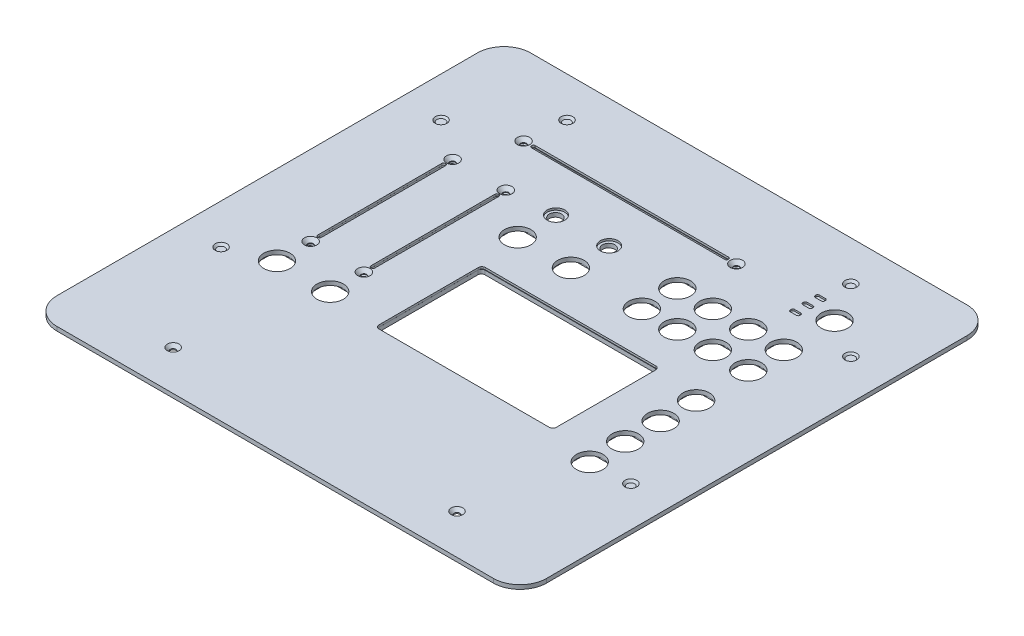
SolidWorks part; units mm, degrees
other "<P-2312 FRONTAL CONSOLA MARINE VIEW>-<Redondeo5>"
other "<P-2312 V02 FRONTAL CONSOLA MARINE VIEW>-<Redondeo5>"
ref_plane "Alzado" through (0, 0, 0) normal (0, 0, 1) x (1, 0, 0)
ref_plane "Planta" through (0, 0, 0) normal (0, 1, 0) x (1, 0, 0)
ref_plane "Vista lateral" through (0, 0, 0) normal (1, 0, 0) x (0, 0, -1)
inserted part "P-2312 V02 FRONTAL CONSOLA MARINE VIEW"
sketch "Croquis2" plane through (0, 2.3, 0) normal (0, 1, 0) x (1, 0, 0)
  line L8 (-39.8558, 56.2352) -> (-31.3705, 64.7204) construction
  line L9 (-106.3558, -34.4648) -> (-85.7558, -34.4648)
  line L10 (-106.3558, -34.4648) -> (-106.3558, -55.0648)
  line L11 (-106.3558, -55.0648) -> (-85.7558, -55.0648)
  line L12 (-85.7558, -34.4648) -> (-85.7558, -55.0648)
  line L13 (-76.3558, -34.4648) -> (-55.7558, -34.4648)
  line L14 (-76.3558, -34.4648) -> (-76.3558, -55.0648)
  line L15 (-76.3558, -55.0648) -> (-55.7558, -55.0648)
  line L16 (-55.7558, -34.4648) -> (-55.7558, -55.0648)
  line L17 (-50.0558, 44.7852) -> (-29.6558, 44.7852)
  line L18 (-50.0558, 44.7852) -> (-50.0558, 24.3852)
  line L19 (-50.0558, 24.3852) -> (-29.6558, 24.3852)
  line L20 (-29.6558, 44.7852) -> (-29.6558, 24.3852)
  line L21 (-20.0558, 44.7852) -> (0.3442, 44.7852)
  line L22 (-20.0558, 44.7852) -> (-20.0558, 24.3852)
  line L23 (-20.0558, 24.3852) -> (0.3442, 24.3852)
  line L24 (0.3442, 44.7852) -> (0.3442, 24.3852)
  line L25 (-88.7558, -36.4648) -> (-103.3558, -36.4648) construction
  line L26 (79.9442, 15.3852) -> (100.5442, 15.3852)
  line L27 (79.9442, 15.3852) -> (79.9442, -65.2148)
  line L28 (79.9442, -65.2148) -> (100.5442, -65.2148)
  line L29 (100.5442, 15.3852) -> (100.5442, -65.2148)
  line L30 (19.9442, 64.8852) -> (100.5442, 64.8852)
  line L31 (19.9442, 64.8852) -> (19.9442, 24.2852)
  line L32 (19.9442, 24.2852) -> (100.5442, 24.2852)
  line L33 (100.5442, 64.8852) -> (100.5442, 24.2852)
  line L34 (79.9442, 93.5352) -> (100.5442, 93.5352)
  line L35 (79.9442, 93.5352) -> (79.9442, 72.9352)
  line L36 (79.9442, 72.9352) -> (100.5442, 72.9352)
  line L37 (100.5442, 93.5352) -> (100.5442, 72.9352)
  line L38 (-103.3558, -53.0648) -> (-88.7558, -53.0648) construction
  line L39 (-104.3558, -37.4648) -> (-104.3558, -52.0648) construction
  line L40 (-87.7558, -52.0648) -> (-87.7558, -37.4648) construction
  line L41 (-74.3558, -37.4648) -> (-74.3558, -52.0648) construction
  line L42 (-57.7558, -52.0648) -> (-57.7558, -37.4648) construction
  line L43 (-58.7558, -36.4648) -> (-73.3558, -36.4648) construction
  line L44 (-73.3558, -53.0648) -> (-58.7558, -53.0648) construction
  line L45 (82.9442, -63.2148) -> (97.5442, -63.2148) construction
  line L46 (98.5442, -62.2148) -> (98.5442, -47.6148) construction
  line L47 (81.9442, -47.6148) -> (81.9442, -62.2148) construction
  line L48 (97.5442, 13.3852) -> (82.9442, 13.3852) construction
  line L49 (62.9442, 26.2852) -> (77.5442, 26.2852) construction
  line L50 (98.5442, 27.2852) -> (98.5442, 41.8852) construction
  line L51 (57.5442, 62.8852) -> (42.9442, 62.8852) construction
  line L52 (21.9442, 61.8852) -> (21.9442, 47.2852) construction
  line L53 (82.9442, 74.9352) -> (97.5442, 74.9352) construction
  line L54 (97.5442, 91.5352) -> (82.9442, 91.5352) construction
  line L55 (98.5442, 75.9352) -> (98.5442, 90.5352) construction
  line L57 (-48.0558, 41.7852) -> (-48.0558, 27.3852) construction
  line L58 (-31.6558, 27.3852) -> (-31.6558, 41.7852) construction
  line L59 (-32.6558, 42.7852) -> (-47.0558, 42.7852) construction
  line L60 (-47.0558, 26.3852) -> (-32.6558, 26.3852) construction
  line L61 (-18.0558, 41.7852) -> (-18.0558, 27.3852) construction
  line L62 (-2.6558, 42.7852) -> (-17.0558, 42.7852) construction
  line L63 (-17.0558, 26.3852) -> (-2.6558, 26.3852) construction
  line L64 (-1.6558, 27.3852) -> (-1.6558, 41.7852) construction
  line L66 (-101.0558, 59.2352) -> (-91.0558, 59.2352)
  line L67 (-101.0558, 59.2352) -> (-101.0558, -30.7648)
  line L68 (-101.0558, -30.7648) -> (-91.0558, -30.7648)
  line L69 (-91.0558, 59.2352) -> (-91.0558, -30.7648)
  line L70 (-71.0558, 59.2352) -> (-61.0558, 59.2352)
  line L71 (-71.0558, 59.2352) -> (-71.0558, -30.7648)
  line L72 (-71.0558, -30.7648) -> (-61.0558, -30.7648)
  line L73 (-61.0558, 59.2352) -> (-61.0558, -30.7648)
  line L75 (-35.9814, 60.8166) -> (-31.724, 65.074)
  line L76 (-35.2743, 60.1095) -> (-31.0169, 64.3669)
  line L77 (-31.724, 65.074) -> (-31.0169, 64.3669)
  line L79 (-5.9814, 60.8166) -> (-1.724, 65.074)
  line L80 (-5.2743, 60.1095) -> (-1.0169, 64.3669)
  line L81 (-1.724, 65.074) -> (-1.0169, 64.3669)
  line L82 (29.4442, 84.3352) -> (-79.5558, 84.3352) construction
  line L83 (-90.0558, 88.2352) -> (39.9442, 88.2352)
  line L84 (-90.0558, 88.2352) -> (-90.0558, 78.2352)
  line L85 (-90.0558, 78.2352) -> (39.9442, 78.2352)
  line L86 (39.9442, 88.2352) -> (39.9442, 78.2352)
  line L87 (-9.8558, 56.2352) -> (-1.3705, 64.7204) construction
  line L89 (-5.2743, 52.3608) -> (-1.0876, 48.1741)
  line L90 (-5.9814, 51.6537) -> (-1.7948, 47.467)
  line L91 (-1.0876, 48.1741) -> (-1.7948, 47.467)
  line L93 (-13.8061, 51.7191) -> (-17.9875, 47.5377)
  line L94 (-14.5014, 52.438) -> (-18.6946, 48.2448)
  line L95 (-17.9875, 47.5377) -> (-18.6946, 48.2448)
  line L97 (-14.3718, 60.1855) -> (-18.6239, 64.4376)
  line L98 (-13.6529, 60.8808) -> (-17.9168, 65.1447)
  line L99 (-18.6239, 64.4376) -> (-17.9168, 65.1447)
  line L100 (-35.9814, 51.6537) -> (-31.7948, 47.467)
  line L101 (-35.2743, 52.3608) -> (-31.0876, 48.1741)
  line L102 (-31.0876, 48.1741) -> (-31.7948, 47.467)
  line L103 (-44.5014, 52.438) -> (-48.6946, 48.2448)
  line L104 (-43.8061, 51.7191) -> (-47.9875, 47.5377)
  line L105 (-47.9875, 47.5377) -> (-48.6946, 48.2448)
  line L106 (-43.6529, 60.8808) -> (-47.9168, 65.1447)
  line L107 (-44.3718, 60.1855) -> (-48.6239, 64.4376)
  line L108 (-48.6239, 64.4376) -> (-47.9168, 65.1447)
  line L109 (119.9442, -86.7648) -> (119.9442, 103.2352) construction
  line L110 (-126.0558, 113.2352) -> (119.9442, 113.2352)
  line L111 (-126.0558, 113.2352) -> (-126.0558, -96.7648)
  line L112 (-126.0558, -96.7648) -> (119.9442, -96.7648)
  line L113 (119.9442, 113.2352) -> (119.9442, -96.7648)
  line L114 (-126.0558, 103.2352) -> (-126.0558, -86.7648) construction
  line L115 (109.9442, 113.2352) -> (-116.0558, 113.2352) construction
  line L116 (-116.0558, -96.7648) -> (109.9442, -96.7648) construction
  arc A3 (-44.3718, 60.1855) -> (-44.5014, 52.438) centre (-39.8558, 56.2352) ccw
  arc A4 (-5.9814, 60.8166) -> (-13.6529, 60.8808) centre (-9.8558, 56.2352) ccw
  arc A10 (-5.2743, 52.3608) -> (-5.2743, 60.1095) centre (-9.8558, 56.2352) ccw
  circle A11 centre (-96.0558, 55.2352) radius 1.6 construction
  circle A12 centre (-66.0558, 55.2352) radius 1.6 construction
  arc A13 (-13.8061, 51.7191) -> (-5.9814, 51.6537) centre (-9.8558, 56.2352) ccw
  circle A14 centre (-85.0558, 83.2352) radius 1.6 construction
  arc A15 (-14.3718, 60.1855) -> (-14.5014, 52.438) centre (-9.8558, 56.2352) ccw
  arc A16 (-43.8061, 51.7191) -> (-35.9814, 51.6537) centre (-39.8558, 56.2352) ccw
  arc A17 (-35.2743, 52.3608) -> (-35.2743, 60.1095) centre (-39.8558, 56.2352) ccw
  arc A18 (-35.9814, 60.8166) -> (-43.6529, 60.8808) centre (-39.8558, 56.2352) ccw
  point P4 (-31.3705, 64.7204)
  point P153 (-39.8558, 56.2352)
  point P162 (-9.8558, 56.2352)
  point P168 (-25.0558, 84.3352)
  point P173 (-39.8558, 56.3059)
  point P181 (-9.8558, 56.3059)
  dimension "D35" = 5
  dimension "D38" = 12
  dimension "D44" = 5
  dimension "D2" = 2
  dimension "D3" = 2
  dimension "D4" = 2
  dimension "D5" = 2
  dimension "D6" = 2
  dimension "D7" = 2
  dimension "D8" = 2
  dimension "D9" = 2
  dimension "D10" = 2
  dimension "D11" = 2
  dimension "D12" = 2
  dimension "D13" = 2
  dimension "D14" = 2
  dimension "D15" = 2
  dimension "D16" = 2
  dimension "D17" = 2
  dimension "D18" = 2
  dimension "D19" = 2
  dimension "D20" = 2
  dimension "D21" = 54
  dimension "D22" = 2
  dimension "D23" = 2
  dimension "D24" = 2
  dimension "D25" = 2
  dimension "D26" = 2
  dimension "D27" = 2
  dimension "D28" = 2
  dimension "D29" = 2
  dimension "D30" = 10
  dimension "D31" = 10
  dimension "D32" = 90
  dimension "D34" = 5
  dimension "D36" = 45
  dimension "D37" = 12
  dimension "D40" = 12
  dimension "D41" = 1
  dimension "D43" = 10
  dimension "D45" = 130
  dimension "D46" = 65
  dimension "D42" = 45
  dimension "D39" = 1
  dimension "D47" = 4
  dimension "D48" = 4
extrude "Saliente-Extruir1" add sketch "Croquis2" along normal blind 0.2 separate body
inserted part "ID-1300 FRONTAL CONSOLA MARINE VIEW"
move or copy body "Sólido-Mover/Copiar2"
fillet "Redondeo1" radius 9 4 edges at (119.9442, 2.4, -113.2352) (-126.0558, 2.4, -113.2352) (119.9442, 2.4, 96.7648) (-126.0558, 2.4, 96.7648)
fillet "Redondeo2" radius 2 40 edges at (39.9442, 2.4, -88.2352) (39.9442, 2.4, -78.2352) (-90.0558, 2.4, -78.2352) (-90.0558, 2.4, -88.2352) (-71.0558, 2.4, -59.2352) (-61.0558, 2.4, -59.2352) (-91.0558, 2.4, -59.2352) (-101.0558, 2.4, -59.2352) (-61.0558, 2.4, 30.7648) (-71.0558, 2.4, 30.7648) (-101.0558, 2.4, 30.7648) (-91.0558, 2.4, 30.7648) (-85.7558, 2.4, 55.0648) (-106.3558, 2.4, 55.0648) (-106.3558, 2.4, 34.4648) (-85.7558, 2.4, 34.4648) (-55.7558, 2.4, 34.4648) (-76.3558, 2.4, 34.4648) (-76.3558, 2.4, 55.0648) (-55.7558, 2.4, 55.0648) (-29.6558, 2.4, -24.3852) (-29.6558, 2.4, -44.7852) (-50.0558, 2.4, -44.7852) (-50.0558, 2.4, -24.3852) (-20.0558, 2.4, -24.3852) (-20.0558, 2.4, -44.7852) (0.3442, 2.4, -44.7852) (0.3442, 2.4, -24.3852) (79.9442, 2.4, 65.2148) (100.5442, 2.4, 65.2148) (100.5442, 2.4, -15.3852) (79.9442, 2.4, -15.3852) (79.9442, 2.4, -93.5352) (79.9442, 2.4, -72.9352) (100.5442, 2.4, -72.9352) (100.5442, 2.4, -93.5352) (100.5442, 2.4, -64.8852) (100.5442, 2.4, -24.2852) (19.9442, 2.4, -24.2852) (19.9442, 2.4, -64.8852)
fillet "Redondeo3" radius 0.5 16 edges at (-18.6946, 2.4, -48.2448) (-17.9875, 2.4, -47.5377) (-1.7948, 2.4, -47.467) (-1.0876, 2.4, -48.1741) (-1.0169, 2.4, -64.3669) (-1.724, 2.4, -65.074) (-17.9168, 2.4, -65.1447) (-18.6239, 2.4, -64.4376) (-48.6239, 2.4, -64.4376) (-47.9168, 2.4, -65.1447) (-31.0169, 2.4, -64.3669) (-31.724, 2.4, -65.074) (-47.9875, 2.4, -47.5377) (-48.6946, 2.4, -48.2448) (-31.0876, 2.4, -48.1741) (-31.7948, 2.4, -47.467)
sketch "Croquis3" plane through (0, 2.5, 0) normal (0, 1, 0) x (1, 0, 0)
  line L0 (110.9442, 113.2352) -> (-117.0558, 113.2352) construction
  line L1 (-111.0558, 113.2352) -> (-96.0558, 113.2352)
  line L2 (-111.0558, 113.2352) -> (-111.0558, 118.2352)
  line L4 (-96.0558, 113.2352) -> (-96.0558, 118.2352)
  line L5 (-126.0558, 104.2352) -> (-126.0558, -87.7648) construction
  line L6 (104.9442, -96.7648) -> (104.9442, -101.7648)
  line L7 (-117.0558, -96.7648) -> (110.9442, -96.7648) construction
  line L8 (104.9442, -96.7648) -> (89.9442, -96.7648)
  line L9 (89.9442, -96.7648) -> (89.9442, -101.7648)
  line L10 (119.9442, -87.7648) -> (119.9442, 104.2352) construction
  arc A0 (-96.0558, 118.2352) -> (-111.0558, 118.2352) centre (-103.5558, 111.6208) ccw
  arc A2 (89.9442, -101.7648) -> (104.9442, -101.7648) centre (97.4442, -95.1505) ccw
  dimension "D4" = 10
  dimension "D5" = 20
  dimension "D1" = 15
  dimension "D2" = 5
  dimension "D3" = 15
  dimension "D6" = 5
  dimension "D7" = 15
  dimension "D8" = 15
extrude "Saliente-Extruir2" add sketch "Croquis3" against normal up to surface (0.2 mm away)
sketch "Croquis4" plane through (0, 2.3, 0) normal (0, -1, 0) x (1, 0, 0)
  line L10 (65.9275, -8.974) -> (65.9275, 47.026)
  line L11 (61.9275, 51.026) -> (-34.0725, 51.026)
  line L12 (-38.0725, 47.026) -> (-38.0725, -8.974)
  line L13 (-34.0725, -12.974) -> (61.9275, -12.974)
  line L14 (65.9275, -8.974) -> (65.9275, 47.026)
  line L15 (61.9275, 51.026) -> (-34.0725, 51.026)
  line L16 (-38.0725, 47.026) -> (-38.0725, -8.974)
  line L17 (-34.0725, -12.974) -> (61.9275, -12.974)
  arc A9 (61.9275, -12.974) -> (65.9275, -8.974) centre (61.9275, -8.974) ccw
  arc A10 (65.9275, 47.026) -> (61.9275, 51.026) centre (61.9275, 47.026) ccw
  arc A11 (-34.0725, 51.026) -> (-38.0725, 47.026) centre (-34.0725, 47.026) ccw
  arc A12 (-38.0725, -8.974) -> (-34.0725, -12.974) centre (-34.0725, -8.974) ccw
  arc A13 (61.9275, -12.974) -> (65.9275, -8.974) centre (61.9275, -8.974) ccw
  arc A14 (65.9275, 47.026) -> (61.9275, 51.026) centre (61.9275, 47.026) ccw
  arc A15 (-34.0725, 51.026) -> (-38.0725, 47.026) centre (-34.0725, 47.026) ccw
  arc A16 (-38.0725, -8.974) -> (-34.0725, -12.974) centre (-34.0725, -8.974) ccw
  dimension "D1" = 2
extrude "Cortar-Extruir1" cut sketch "Croquis4" against normal blind 10
inserted part "P-2312 FRONTAL CONSOLA MARINE VIEW"
move or copy body "Sólido-Mover/Copiar6" placed by mates yes
other "Distancia2" parameters "D1"=0
sketch "Croquis11" plane through (0, 2.3, 0) normal (0, 1, 0) x (1, 0, 0)
  circle A0 centre (-118.5558, -53.7648) radius 4
  circle A1 centre (-83.0558, -89.2648) radius 4
  circle A2 centre (-118.5558, 64.2352) radius 4
  circle A3 centre (-83.0558, 105.7352) radius 4
  circle A4 centre (76.9442, 105.7352) radius 4
  circle A5 centre (112.4442, 64.2352) radius 4
  circle A6 centre (112.4442, -53.7648) radius 4
  circle A7 centre (76.9442, -89.2648) radius 4
  dimension "D1" = 8
extrude "Cortar-Extruir3" cut sketch "Croquis11" against normal through all and the other way through all
